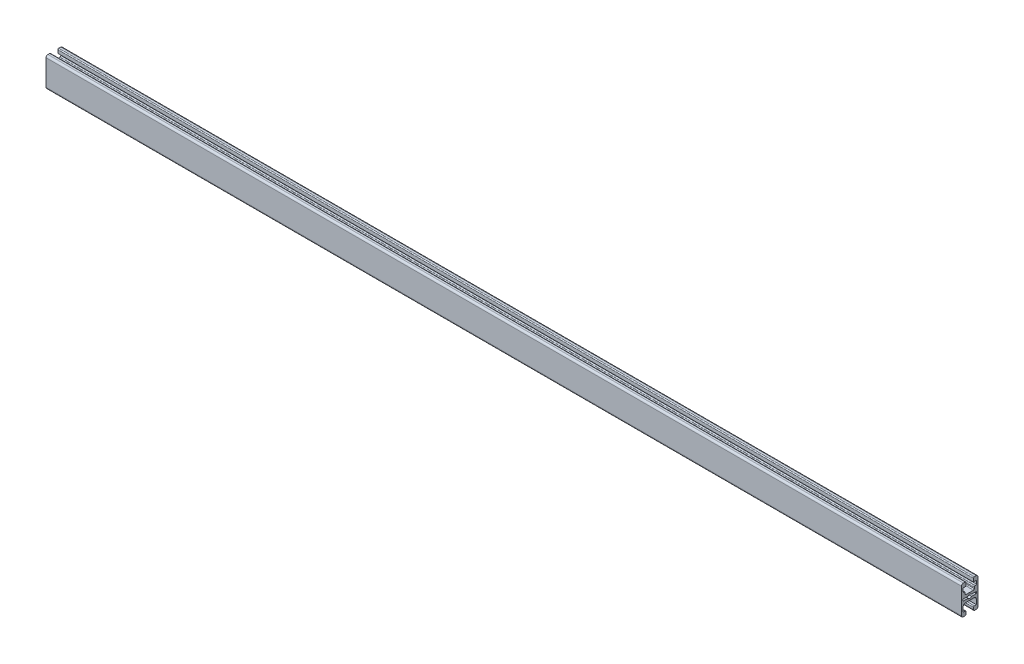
SolidWorks part; units mm, degrees
ref_plane "Ebene vorne" through (0, 0, 0) normal (0, 0, 1) x (1, 0, 0)
ref_plane "Ebene oben" through (0, 0, 0) normal (0, 1, 0) x (1, 0, 0)
ref_plane "Ebene rechts" through (0, 0, 0) normal (1, 0, 0) x (0, 0, -1)
sketch "Skizze1" plane through (0, 0, 0) normal (0, 1, 0) x (1, 0, 0)
  line L0 (0, 0) -> (1000, 0)
  dimension "D1" = 1000
other "Strukturbauteil1"
ref_plane "Ebene1" through (0, 0, 0) normal (1, 0, 0) x (0, 0, -1)
sketch "Model" plane through (0, 0, 0) normal (1, 0, 0) x (0, 0, -1)
  line L0 (-9, -14) -> (-9, 14)
  line L1 (-7, 16) -> (-5, 16)
  line L2 (-4, 15) -> (-4, 11.5)
  line L3 (-4, 11.5) -> (-7.175, 11.5)
  line L4 (-7.175, 11.5) -> (-7.175, 8)
  line L5 (-6.175, 7) -> (-6, 7)
  line L6 (-5, 6) -> (-5, 4.75)
  line L7 (-4, 3.75) -> (4, 3.75)
  line L8 (5, 4.75) -> (5, 6)
  line L9 (6, 7) -> (6.175, 7)
  line L10 (7.175, 8) -> (7.175, 11.5)
  line L11 (7.175, 11.5) -> (4, 11.5)
  line L12 (4, 11.5) -> (4, 15)
  line L13 (5, 16) -> (7, 16)
  line L14 (9, 14) -> (9, -14)
  line L15 (7, -16) -> (5.5, -16)
  line L16 (4, -14.5) -> (4, -12.5)
  line L17 (5, -11.5) -> (7.175, -11.5)
  line L18 (7.175, -11.5) -> (7.175, -6.25)
  line L19 (4.675, -3.75) -> (-4.675, -3.75)
  line L20 (-7.175, -6.25) -> (-7.175, -11.5)
  line L21 (-7.175, -11.5) -> (-5, -11.5)
  line L22 (-4, -12.5) -> (-4, -14.5)
  line L23 (-5.5, -16) -> (-7, -16)
  line L24 (-1.8466, -1) -> (-7.175, -1)
  line L25 (-7.175, -1) -> (-7.175, 1)
  line L26 (-7.175, 1) -> (-1.8466, 1)
  line L27 (1.8466, 1) -> (7.175, 1)
  line L28 (7.175, 1) -> (7.175, -1)
  line L29 (7.175, -1) -> (1.8466, -1)
  line L30 (0, 0) -> (0, 16) construction
  line L31 (0, 0) -> (0, -16) construction
  line L33 (-9, -16) -> (9, -16) construction
  line L34 (-9, -16) -> (-9, 16) construction
  line L35 (-9, 16) -> (9, 16) construction
  line L36 (9, -16) -> (9, 16) construction
  line L37 (-9, -16) -> (9, 16) construction
  line L38 (-9, 16) -> (9, -16) construction
  arc A0 (-7, 16) -> (-9, 14) centre (-7, 14) ccw
  arc A1 (-4, 15) -> (-5, 16) centre (-5, 15) ccw
  arc A2 (-7.175, 8) -> (-6.175, 7) centre (-6.175, 8) ccw
  arc A3 (-5, 6) -> (-6, 7) centre (-6, 6) ccw
  arc A4 (-5, 4.75) -> (-4, 3.75) centre (-4, 4.75) ccw
  arc A5 (4, 3.75) -> (5, 4.75) centre (4, 4.75) ccw
  arc A6 (6, 7) -> (5, 6) centre (6, 6) ccw
  arc A7 (6.175, 7) -> (7.175, 8) centre (6.175, 8) ccw
  arc A8 (5, 16) -> (4, 15) centre (5, 15) ccw
  arc A9 (9, 14) -> (7, 16) centre (7, 14) ccw
  arc A10 (7, -16) -> (9, -14) centre (7, -14) ccw
  arc A11 (4, -14.5) -> (5.5, -16) centre (5.5, -14.5) ccw
  arc A12 (5, -11.5) -> (4, -12.5) centre (5, -12.5) ccw
  arc A13 (7.175, -6.25) -> (4.675, -3.75) centre (4.675, -6.25) ccw
  arc A14 (-4.675, -3.75) -> (-7.175, -6.25) centre (-4.675, -6.25) ccw
  arc A15 (-4, -12.5) -> (-5, -11.5) centre (-5, -12.5) ccw
  arc A16 (-5.5, -16) -> (-4, -14.5) centre (-5.5, -14.5) ccw
  arc A17 (-9, -14) -> (-7, -16) centre (-7, -14) ccw
  arc A18 (1.8466, 1) -> (-1.8466, 1) centre (0, 0) ccw
  arc A19 (-1.8466, -1) -> (1.8466, -1) centre (0, 0) ccw
  point P75 (0, 0)
  point P76 (-9, 0)
  point P77 (9, 0)
  point P78 (0, 0)
  point P79 (0, -16)
  point P80 (0, 16)
